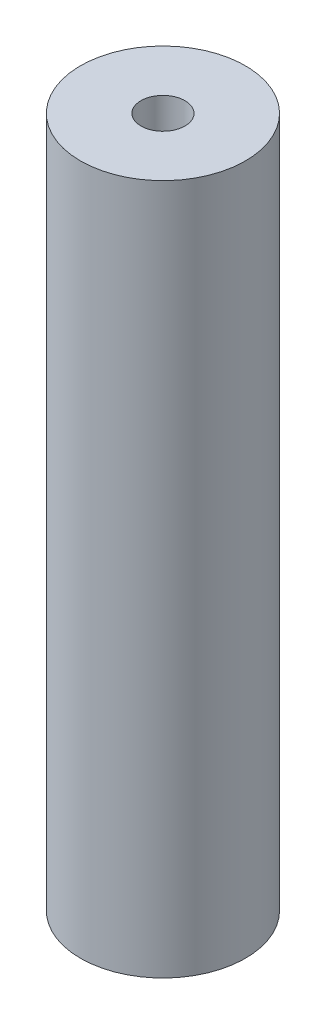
SolidWorks part; units mm, degrees
ref_plane "Front Plane" through (0, 0, 0) normal (0, 0, 1) x (1, 0, 0)
ref_plane "Top Plane" through (0, 0, 0) normal (0, 1, 0) x (1, 0, 0)
ref_plane "Right Plane" through (0, 0, 0) normal (1, 0, 0) x (0, 0, -1)
sketch "Sketch1" plane through (0, 0, 0) normal (0, 1, 0) x (1, 0, 0)
  circle A0 centre (0, 0) radius 4.7625
  dimension "D1" = 9.525
extrude "Boss-Extrude1" add sketch "Sketch1" along normal blind 39.878
sketch "Sketch2" plane through (0, 39.878, 0) normal (0, 1, 0) x (1, 0, 0)
  circle A0 centre (0, 0) radius 1.27
  dimension "D1" = 2.54
extrude "Cut-Extrude1" cut sketch "Sketch2" against normal through all
